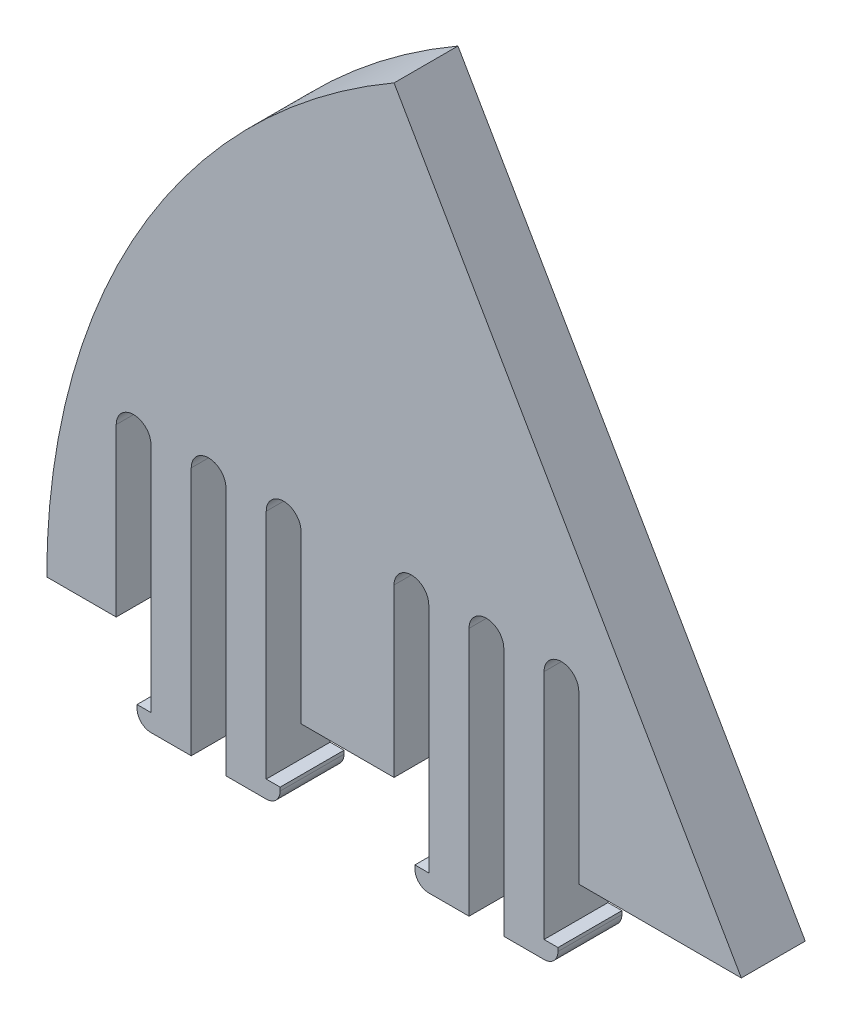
SolidWorks part; units mm, degrees
ref_plane "Front Plane" through (0, 0, 0) normal (0, 0, 1) x (1, 0, 0)
ref_plane "Top Plane" through (0, 0, 0) normal (0, 1, 0) x (1, 0, 0)
ref_plane "Right Plane" through (0, 0, 0) normal (1, 0, 0) x (0, 0, -1)
sketch "Sketch1" plane through (0, 0, 0) normal (0, 0, 1) x (1, 0, 0)
  line L0 (0, 0) -> (-14.859, 0)
  line L1 (0, 0) -> (-31.75, 54.9926)
  line L2 (-57.15, 15.24) -> (-32.7293, 15.24) construction
  line L3 (-57.15, 0) -> (-57.15, 15.24)
  line L4 (-53.975, -5.969) -> (-53.975, 15.24)
  line L5 (-55.245, -6.2865) -> (-55.245, -5.969)
  line L6 (-50.292, -7.5565) -> (-50.292, 15.24)
  line L7 (-47.117, -7.5565) -> (-47.117, 15.24)
  line L8 (-55.245, -5.969) -> (-53.975, -5.969)
  line L9 (-43.434, -5.969) -> (-43.434, 15.24)
  line L10 (-40.259, 0) -> (-40.259, 15.24)
  line L11 (-57.15, 0) -> (-63.5, 0)
  line L12 (-50.292, -7.5565) -> (-53.975, -7.5565)
  line L13 (-48.7045, 15.24) -> (-48.7045, -12.5201) construction
  line L14 (-47.117, -7.5565) -> (-43.434, -7.5565)
  line L15 (-42.164, -5.969) -> (-43.434, -5.969)
  line L16 (-42.164, -6.2865) -> (-42.164, -5.969)
  line L17 (-31.75, 0) -> (-31.75, 15.24)
  line L18 (-28.575, -5.969) -> (-28.575, 15.24)
  line L19 (-29.845, -6.2865) -> (-29.845, -5.969)
  line L20 (-24.892, -7.5565) -> (-24.892, 15.24)
  line L21 (-21.717, -7.5565) -> (-21.717, 15.24)
  line L22 (-29.845, -5.969) -> (-28.575, -5.969)
  line L23 (-18.034, -5.969) -> (-18.034, 15.24)
  line L24 (-14.859, 0) -> (-14.859, 15.24)
  line L25 (-24.892, -7.5565) -> (-28.575, -7.5565)
  line L26 (-21.717, -7.5565) -> (-18.034, -7.5565)
  line L27 (-16.764, -5.969) -> (-18.034, -5.969)
  line L28 (-16.764, -6.2865) -> (-16.764, -5.969)
  line L29 (-31.75, 0) -> (-40.259, 0)
  arc A0 (-31.75, 54.9926) -> (-63.5, 0) centre (0, 0) ccw
  arc A1 (-55.245, -6.2865) -> (-53.975, -7.5565) centre (-53.975, -6.2865) ccw
  arc A2 (-53.975, 15.24) -> (-57.15, 15.24) centre (-55.5625, 15.24) ccw
  arc A3 (-42.164, -6.2865) -> (-43.434, -7.5565) centre (-43.434, -6.2865) cw
  arc A4 (-47.117, 15.24) -> (-50.292, 15.24) centre (-48.7045, 15.24) ccw
  arc A5 (-29.845, -6.2865) -> (-28.575, -7.5565) centre (-28.575, -6.2865) ccw
  arc A6 (-40.259, 15.24) -> (-43.434, 15.24) centre (-41.8465, 15.24) ccw
  arc A7 (-28.575, 15.24) -> (-31.75, 15.24) centre (-30.1625, 15.24) ccw
  arc A8 (-16.764, -6.2865) -> (-18.034, -7.5565) centre (-18.034, -6.2865) cw
  arc A9 (-21.717, 15.24) -> (-24.892, 15.24) centre (-23.3045, 15.24) ccw
  arc A10 (-14.859, 15.24) -> (-18.034, 15.24) centre (-16.4465, 15.24) ccw
  point P7 (-55.245, 8.7835)
  point P15 (-48.7045, 7.62)
  point P22 (-40.2022, 7.62)
  point P36 (-29.845, 8.7835)
  point P44 (-23.3045, 7.62)
  point P50 (-14.8022, 7.62)
  dimension "D3" = 1.5875
  dimension "D10" = 1.27
  dimension "D1" = 63.5
  dimension "D2" = 60
  dimension "D4" = 1.27
  dimension "D5" = 3.175
  dimension "D6" = 3.175
  dimension "D7" = 3.175
  dimension "D8" = 3.683
  dimension "D9" = 3.683
  dimension "D11" = 6.35
  dimension "D12" = 5.969
  dimension "D13" = 1.5875
  dimension "D14" = 2
extrude "Boss-Extrude1" add sketch "Sketch1" along normal blind 5.842
